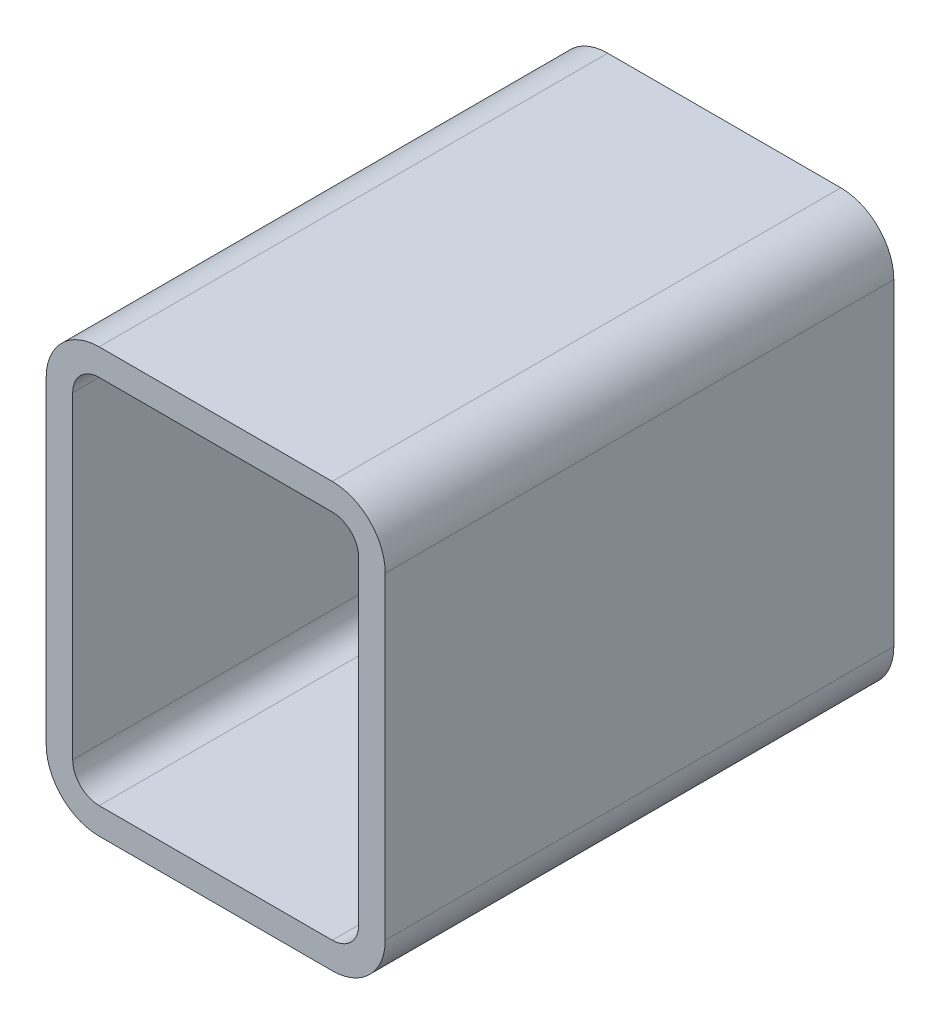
SolidWorks part; units mm, degrees
ref_plane "Front Plane" through (0, 0, 0) normal (0, 0, 1) x (1, 0, 0)
ref_plane "Top Plane" through (0, 0, 0) normal (0, 1, 0) x (1, 0, 0)
ref_plane "Right Plane" through (0, 0, 0) normal (1, 0, 0) x (0, 0, -1)
sketch "Sketch1" plane through (0, 0, 0) normal (0, 0, 1) x (1, 0, 0)
sketch_block_instance "HSS10x8x0.625-1"
sketch_block "HSS10x8x0.625"
extrude "Boss-Extrude1" add sketch "Sketch1" along normal blind 304.8
